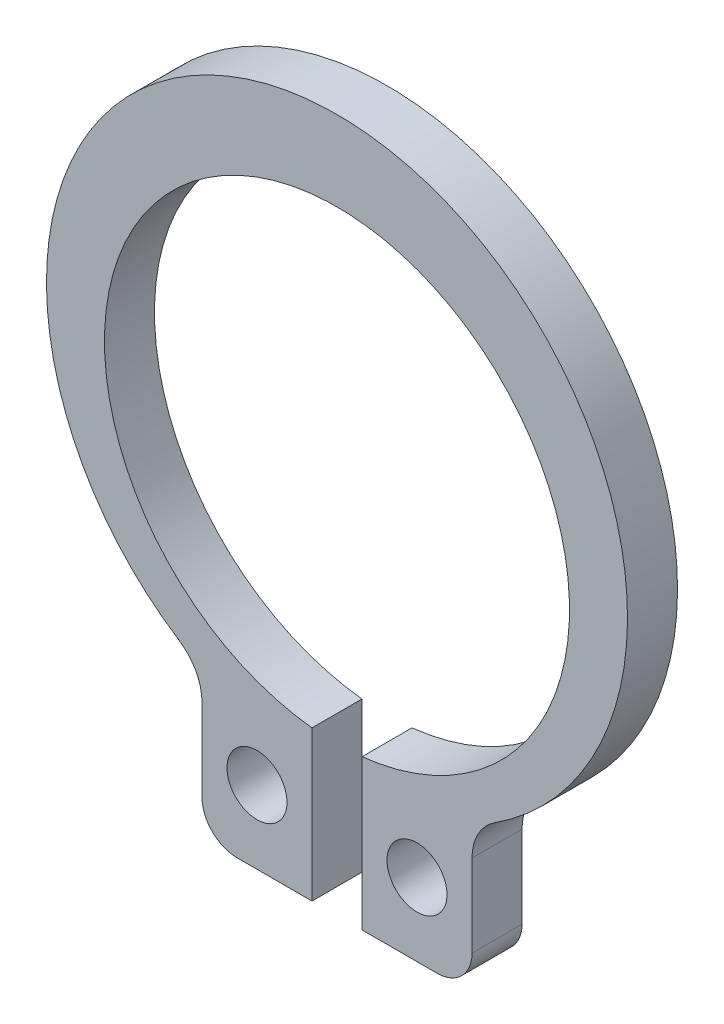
SolidWorks part; units mm, degrees
ref_plane "Front Plane" through (0, 0, 0) normal (0, 0, 1) x (1, 0, 0)
ref_plane "Top Plane" through (0, 0, 0) normal (0, 1, 0) x (1, 0, 0)
ref_plane "Right Plane" through (0, 0, 0) normal (1, 0, 0) x (0, 0, -1)
sketch "BodySke" plane through (0, 0, 0) normal (0, 0, 1) x (1, 0, 0)
  line L0 (0, 0) -> (0, 21.0564) construction
  line L1 (0, 0) -> (0, -11.0385) construction
  line L2 (-0.5, -4.623) -> (-0.5, -7.623)
  line L3 (-0.5, -7.623) -> (-2.7, -7.623)
  line L4 (-2.7, -7.623) -> (-2.7, -4.7045)
  line L5 (2.7, -6.1638) -> (3.9811, -6.1638) construction
  line L7 (0.5, -7.623) -> (2.7, -7.623)
  line L8 (0.5, -4.623) -> (0.5, -7.623)
  line L9 (2.7, -7.623) -> (2.7, -4.7045)
  arc A0 (0.5, -4.623) -> (-0.5, -4.623) centre (0, 0) ccw
  circle A2 centre (-1.6, -6.1638) radius 0.6
  circle A3 centre (1.6, -6.1638) radius 0.6
  arc A4 (2.7, -4.7045) -> (-2.7, -4.7045) centre (0, 0.44) ccw
  dimension "D1" = 0.5
  dimension "Groove_Diameter" = 9.3
  dimension "D2" = 0.5
  dimension "D3" = 5.81
  dimension "dia" = 1.2
  dimension "Groove_Depth" = 1.6
  dimension "Thickness" = 1
  dimension "Groove_length" = 3
extrude "BaseBody" add sketch "BodySke" along normal blind 1
fillet "Fillet1" radius 1 2 edges at (2.7, -4.7045, 0.5) (-2.7, -4.7045, 0.5)
fillet "Fillet2" radius 0.7 2 edges at (2.7, -7.623, 0.5) (-2.7, -7.623, 0.5)
equation "\"D1@BodySke\" = \"Thickness@BodySke\" / 2"
equation "\"D2@BodySke\" = \"Thickness@BodySke\" / 2"
equation "\"D3@BodySke\" =  ( \"Groove_Diameter@BodySke\" + 1.45 * \"Groove_Depth@BodySke\" )  / 2"
equation "\"Thickness@BaseBody\" = \"Thickness@BodySke\""
equation "\"D1@Fillet1\" = \"Thickness@BodySke\""
equation "\"D1@Fillet2\" = \"Thickness@BodySke\" * 0.7"
